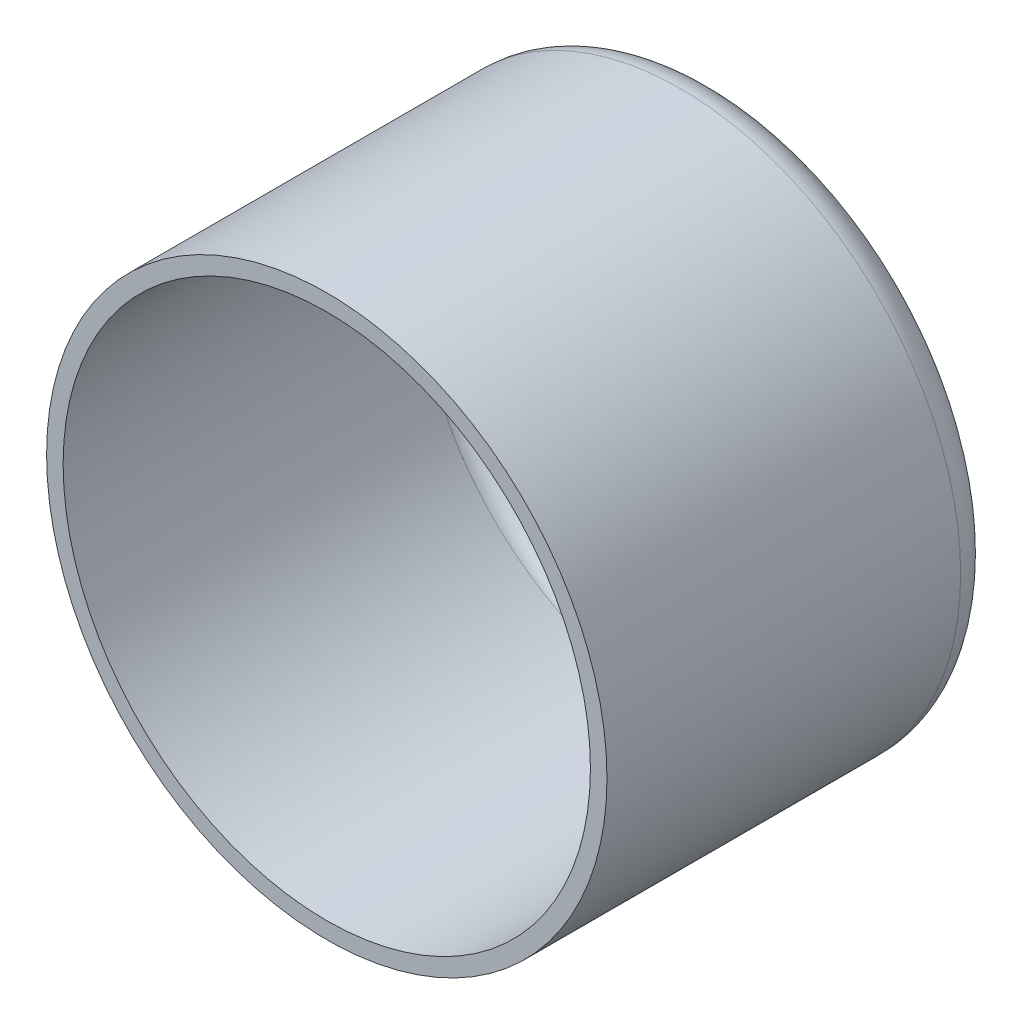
SolidWorks part; units mm, degrees
ref_plane "Front" through (0, 0, 0) normal (0, 0, 1) x (1, 0, 0)
ref_plane "Top" through (0, 0, 0) normal (0, 1, 0) x (1, 0, 0)
ref_plane "Right" through (0, 0, 0) normal (1, 0, 0) x (0, 0, -1)
sketch "Sketch1" plane through (0, 0, 0) normal (1, 0, 0) x (0, 0, -1)
  line L0 (-15.24, 0) -> (15.24, 0) construction
  line L1 (15.24, 0) -> (15.24, 21.9329) construction
  line L2 (15.24, 21.9329) -> (-15.24, 21.9329) construction
  line L3 (-15.24, 21.9329) -> (-15.24, 20.6375)
  line L4 (-15.24, 20.6375) -> (13.9446, 20.6375) construction
  line L5 (13.9446, 20.6375) -> (13.9446, 0) construction
  line L7 (13.9446, 0) -> (15.24, 0)
  line L8 (-15.24, 21.9329) -> (12.446, 21.9329)
  line L9 (-15.24, 20.6375) -> (12.446, 20.6375)
  line L10 (13.9446, 19.1389) -> (13.9446, 0)
  line L11 (15.24, 19.1389) -> (15.24, 0)
  arc A0 (12.446, 20.6375) -> (13.9446, 19.1389) centre (12.446, 19.1389) cw
  arc A1 (12.446, 21.9329) -> (15.24, 19.1389) centre (12.446, 19.1389) cw
  dimension "Th" = 1.2954
  dimension "Length" = 30.48
  dimension "ID" = 41.275
  dimension "Edge" = 2.794
revolve "Revolve1" add sketch "Sketch1" angle 360 about L0
